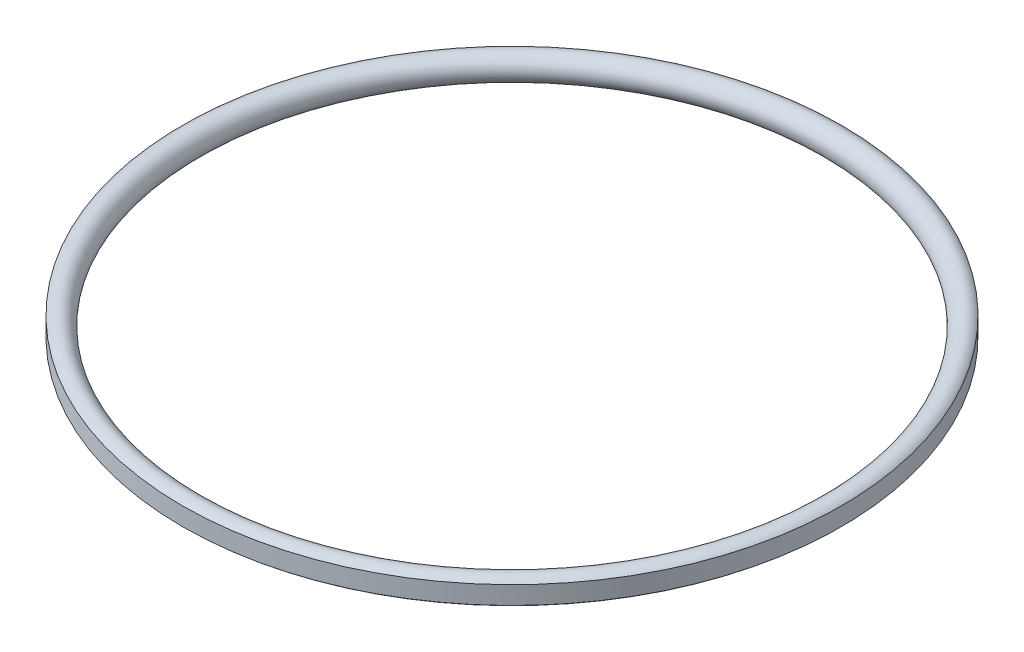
SolidWorks part; units mm, degrees
ref_plane "Face" through (0, 0, 0) normal (0, 0, 1) x (1, 0, 0)
ref_plane "Dessus" through (0, 0, 0) normal (0, 1, 0) x (1, 0, 0)
ref_plane "Côté" through (0, 0, 0) normal (1, 0, 0) x (0, 0, -1)
sketch "Esquisse1" plane through (0, 0, 0) normal (0, 0, 1) x (1, 0, 0)
  line L0 (0, 0) -> (0, 15.7513) construction
  line L1 (0, 0) -> (-8.3073, 0) construction
  circle A0 centre (-67.015, 2.665) radius 2.665
  dimension "D1" = 5.33
  dimension "D2" = 128.7
revolve "Base-Révolution" add sketch "Esquisse1" angle 360 about L0
sketch "Esquisse3" plane through (0, 0, 0) normal (0, 1, 0) x (1, 0, 0)
  circle A0 centre (0, 0) radius 68.9
  dimension "D1" = 137.8
extrude "Tronquage" cut sketch "Esquisse3" along normal blind 33.7 flip side to cut
